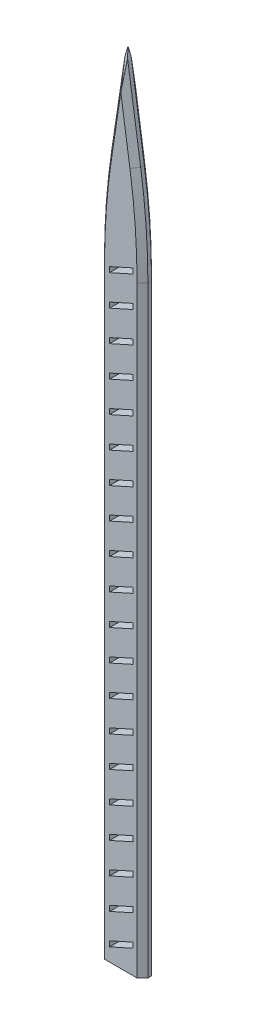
SolidWorks part; units mm, degrees
ref_plane "Front Plane" through (0, 0, 0) normal (0, 0, 1) x (1, 0, 0)
ref_plane "Top Plane" through (0, 0, 0) normal (0, 1, 0) x (1, 0, 0)
ref_plane "Right Plane" through (0, 0, 0) normal (1, 0, 0) x (0, 0, -1)
sketch "Sketch1" plane through (0, 0, 0) normal (0, 1, 0) x (1, 0, 0)
  line L0 (-65.4945, 32.1332) -> (-53.4945, 32.1332)
  line L1 (-53.4945, 32.1332) -> (-53.4945, 28.1332)
  line L2 (-53.4945, 28.1332) -> (-65.4945, 28.1332)
  line L3 (-65.4945, 28.1332) -> (-65.4945, 32.1332)
extrude "Boss-Extrude1" add sketch "Sketch1" along normal blind 130
sketch "Sketch3" plane through (0, 130, 0) normal (0, 1, 0) x (1, 0, 0)
  line L0 (-65.4945, 32.1332) -> (-53.4945, 32.1332)
  line L1 (-53.4945, 32.1332) -> (-53.4945, 28.1332)
  line L2 (-53.4945, 28.1332) -> (-65.4945, 28.1332)
  line L3 (-65.4945, 28.1332) -> (-65.4945, 32.1332)
extrude "Boss-Extrude3" add sketch "Sketch3" along normal blind 90
sketch "Sketch4" plane through (0, 0, -32.1332) normal (0, 0, -1) x (-1, 0, 0)
  line L0 (59.4945, 220) -> (55.4783, 193.1728)
  line L1 (53.4945, 220) -> (65.4945, 220) construction
  line L2 (53.4945, 220) -> (53.4945, 0) construction
  line L3 (59.4945, 220) -> (63.5107, 193.1728)
  line L4 (65.4945, 220) -> (65.4945, 0) construction
  line L5 (53.4945, 166.5226) -> (53.4945, 156.195)
  line L6 (65.4945, 166.5226) -> (65.4945, 156.195)
  line L7 (53.4945, 156.195) -> (48.8799, 156.195)
  line L8 (48.8799, 156.195) -> (48.8799, 232.3333)
  line L9 (48.8799, 232.3333) -> (75.2659, 232.3333)
  line L10 (75.2659, 232.3333) -> (75.2659, 156.195)
  line L11 (75.2659, 156.195) -> (65.4945, 156.195)
  arc A0 (53.4945, 166.5226) -> (55.4783, 193.1728) centre (233.4945, 166.5226) cw
  arc A1 (65.4945, 166.5226) -> (63.5107, 193.1728) centre (-114.5055, 166.5226) ccw
  point P13 (53.4945, 179.9216)
  point P16 (65.4945, 179.9216)
  dimension "D1" = 180
  dimension "D2" = 180
extrude "Cut-Extrude1" cut sketch "Sketch4" against normal blind 70
chamfer "Chamfer1" distance 1.5 angle 45 12 edges at (-53.4945, 83.2613, -32.1332) (-65.4945, 83.2613, -32.1332) (-53.9911, 179.8846, -32.1332) (-57.4864, 206.5864, -32.1332) (-61.5026, 206.5864, -32.1332) (-64.9978, 179.8846, -32.1332) (-53.4945, 83.2613, -28.1332) (-65.4945, 83.2613, -28.1332) (-53.9911, 179.8846, -28.1332) (-57.4864, 206.5864, -28.1332) (-61.5026, 206.5864, -28.1332) (-64.9978, 179.8846, -28.1332)
sketch "Sketch5" plane through (-53.4945, 0, 0) normal (1, 0, 0) x (0, 0, -1)
  line L0 (30.1332, 220) -> (28.1332, 209.8687)
  line L1 (29.6332, 220) -> (30.6332, 220) construction
  line L2 (28.1332, 209.8687) -> (28.1332, 221.793)
  line L3 (28.1332, 221.793) -> (32.6491, 221.793)
  line L4 (32.6491, 221.793) -> (32.1332, 209.8687)
  line L5 (32.1332, 209.8687) -> (30.1332, 220)
extrude "Cut-Extrude2" cut sketch "Sketch5" against normal blind 70
sketch "Sketch6" plane through (0, 0, -32.1332) normal (0, 0, -1) x (-1, 0, 0)
  line L0 (56.0937, 6.5779) -> (62.5961, 3.6518)
  line L1 (62.5961, 3.6518) -> (62.5961, 5.1148)
  line L2 (62.5961, 5.1148) -> (56.0937, 8.0409)
  line L3 (56.0937, 8.0409) -> (56.0937, 6.5779)
extrude "Cut-Extrude3" cut sketch "Sketch6" against normal blind 70
pattern_linear "LPattern1" count 20 spacing 8.5 along (0, 1, 0) of "Cut-Extrude3"
